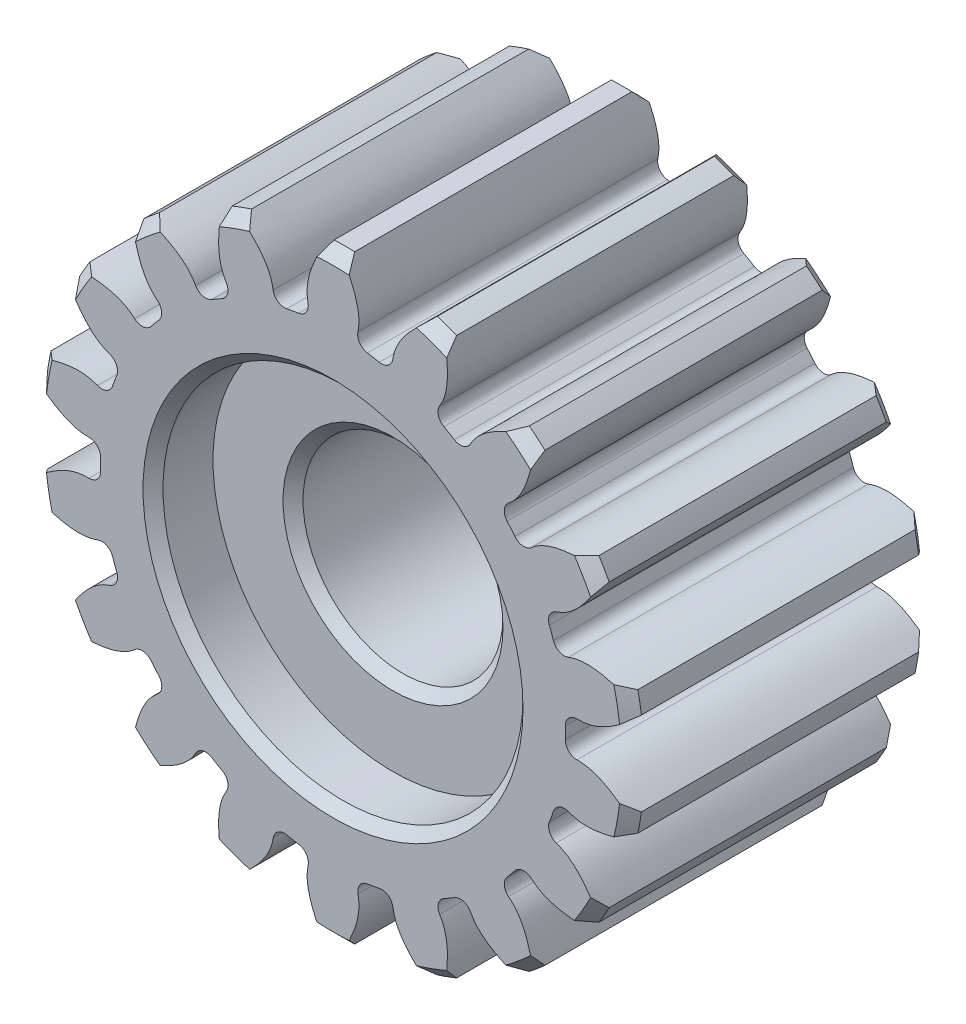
SolidWorks part; units mm, degrees
ref_plane "Plan1" through (0, 0, 0) normal (0, 0, 1) x (1, 0, 0)
ref_plane "Plan2" through (0, 0, 0) normal (0, 1, 0) x (1, 0, 0)
ref_plane "Plan3" through (0, 0, 0) normal (1, 0, 0) x (0, 0, -1)
sketch "Dent" plane through (0, 0, 0) normal (0, 0, 1) x (1, 0, 0)
  line L1 (-0.5128, 10.2479) -> (0, 8.8389)
  line L3 (0, 15) -> (0, -15) construction
  line L4 (0, 0) -> (0.5128, 14.9912) construction
  line L5 (1.1781, 13.4485) -> (-1.1781, 13.4485) construction
  line L6 (1.2953, 12.6196) -> (-1.2953, 12.6196) construction
  line L7 (-0.75, 0) -> (0.75, 0) construction
  line L9 (0.5128, 10.2479) -> (0, 8.8389)
  line L11 (0, 0) -> (1.1781, 13.4485) construction
  line L12 (0, 0) -> (1.2953, 12.6196) construction
  circle A0 centre (0, 0) radius 13.5 construction
  circle A1 centre (0, 0) radius 15 construction
  arc A2 (0.5128, 14.9912) -> (-0.5128, 14.9912) centre (0, 0) ccw
  circle A3 centre (0, 0) radius 12.6859 construction
  point P2 (-1.1781, 13.4485)
  point P3 (-1.2953, 12.6196)
  point P19 (1.1781, 13.4485)
  point P20 (1.2953, 12.6196)
sketch "Esquisse2" plane through (0, 0, 0) normal (0, 0, 1) x (1, 0, 0)
  circle A0 centre (0, 0) radius 11.625
extrude "Base-Extrusion" add sketch "Esquisse2" against normal blind 15
extrude "Boss.-Extru.1" add sketch "Dent" against normal blind 15
fillet "Congé1" radius 0.57 4 edges at (1.0666, 11.576, -7.5) (-1.0797, 11.5747, -7.5)
chamfer "Chanfrein1" distance 0.57 angle 45 4 edges at (0, 15, -15) (0, 15, 0)
pattern_circular "Répétition circulaire1" count 18 over 360 about axis through (0, 0, -15) along (0, 0, 1) of "Congé1", "Boss.-Extru.1", "Chanfrein1"
sketch "Esquisse3" plane through (0, 0, 0) normal (0, 0, 1) x (1, 0, 0)
  circle A0 centre (0, 0) radius 5
  dimension "D1" = 10
extrude "Enlèv. mat.-Extru.1" cut sketch "Esquisse3" against normal through all
sketch "Esquisse4" plane through (0, 0, 0) normal (0, 0, 1) x (1, 0, 0)
  circle A0 centre (0, 0) radius 9
  dimension "D1" = 18
extrude "Enlèv. mat.-Extru.2" cut sketch "Esquisse4" against normal blind 3
chamfer "Chanfrein2" distance 0.5 angle 45 3 edges at (5, 0, -15) (9, 0, 0) (5, 0, -3)
sketch "Esquisse5" plane through (0, 0, -15) normal (0, 0, -1) x (-1, 0, 0)
  line L0 (0, 0) -> (0, 11.1543)
  line L1 (0, 0) -> (-1.8963, 10.7544)
  line L2 (0, 0) -> (-7.8256, -6.5664)
  line L3 (0, 0) -> (9.7576, -3.5515)
  dimension "D1" = 10
  dimension "D2" = 120
  dimension "D3" = 120
equation "\"Dp@Dent\" = \"Module@Dent\"*\"Nbr de dents@Répétition circulaire1\" "
equation "\"Dt@Dent\" = \"Module@Dent\"*(\"Nbr de dents@Répétition circulaire1\"+2)"
equation "\"Dpied@Esquisse2\" = \"Dp@Dent\"-(2.5*\"Module@Dent\")"
equation "\"Db@Dent\" = \"Dp@Dent\"*cos(\"Angle de pression@Dent\"*pi/180)"
equation "\"Ep au primitif@Dent\" =  (pi*\"Dp@Dent\"/2)/\"Nbr de dents@Répétition circulaire1\""
equation "\"D3@Dent\"=atn((Sin((sqr(((\"Dt@Dent\"/\"Db@Dent\")^2)-1))) -((sqr(((\"Dt@Dent\"/\"Db@Dent\")^2)-1)) * Cos((sqr(((\"Dt@Dent\"/\"Db@Dent\")^2)-1)))))/(Cos((sqr(((\"Dt@Dent\"/\"Db@Dent\")^2)-1))) +((sqr(((\"Dt@Dent\"/\"Db@"
equation "\"D4@Dent\"=atn((Sin((sqr(((\"Dp@Dent\"/\"Db@Dent\")^2)-1))) -((sqr(((\"Dp@Dent\"/\"Db@Dent\")^2)-1)) * Cos((sqr(((\"Dp@Dent\"/\"Db@Dent\")^2)-1)))))/(Cos((sqr(((\"Dp@Dent\"/\"Db@Dent\")^2)-1))) +((sqr(((\"Dp@Dent\"/\"Db@"
equation "\"D1@Congé1\" = \"Module@Dent\"*0.38"
equation "\"D1@Base-Extrusion\" = \"Epaisseur@Boss.-Extru.1\""
